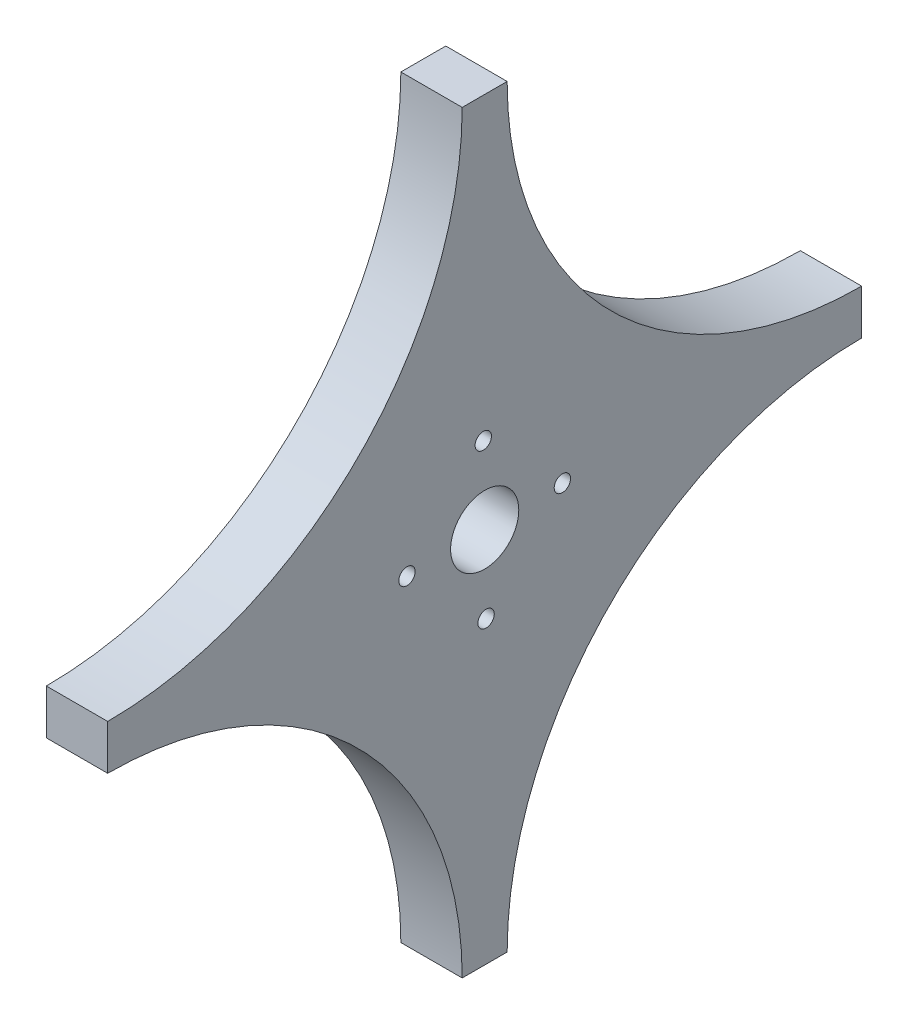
SolidWorks part; units mm, degrees
ref_plane "Front Plane" through (0, 0, 0) normal (0, 0, 1) x (1, 0, 0)
ref_plane "Top Plane" through (0, 0, 0) normal (0, 1, 0) x (1, 0, 0)
ref_plane "Right Plane" through (0, 0, 0) normal (1, 0, 0) x (0, 0, -1)
sketch "Sketch1" plane through (0, 0, 0) normal (1, 0, 0) x (0, 0, -1)
  line L0 (2.0928, 35.1128) -> (-2.0928, 35.1128)
  line L1 (2.0928, 35.1128) -> (2.0928, 64.3697) construction
  line L2 (35.1128, 2.0928) -> (86.5266, 2.0928) construction
  line L3 (35.1128, 2.0928) -> (35.1128, -2.0928)
  line L5 (-2.0928, -35.1128) -> (2.0928, -35.1128)
  line L6 (-35.1128, 2.0928) -> (-35.1128, -2.0928)
  line L7 (35.1128, -2.0928) -> (35.1128, 2.0928)
  circle A1 centre (0, 0) radius 3.175
  arc A6 (2.0928, 35.1128) -> (35.1128, 2.0928) centre (35.1128, 35.1128) ccw
  arc A7 (35.1128, -2.0928) -> (2.0928, -35.1128) centre (35.1128, -35.1128) ccw
  arc A8 (-2.0928, -35.1128) -> (-35.1128, -2.0928) centre (-35.1128, -35.1128) ccw
  arc A9 (-35.1128, 2.0928) -> (-2.0928, 35.1128) centre (-35.1128, 35.1128) ccw
  point P9 (36.1282, 0)
  point P10 (11.7641, 11.7641)
  point P11 (0, 35.1128)
  point P27 (0, 0)
  dimension "D1" = 6.35
  dimension "D2" = 33.02
  dimension "D4" = 16.637
  dimension "D3" = 4
extrude "Boss-Extrude1" add sketch "Sketch1" along normal blind 5.715
sketch "Sketch3" plane through (5.715, 0, 0) normal (-1, 0, 0) x (0, 0, 1)
  circle A0 centre (7.1766, -3.4965) radius 0.762 construction
  circle A1 centre (7.2378, -0.1316) radius 0.762 construction
  circle A2 centre (7.299, 3.2334) radius 0.762 construction
  circle A3 centre (3.4965, 7.1766) radius 0.762 construction
  circle A4 centre (0.1316, 7.2378) radius 0.762 construction
  circle A5 centre (-3.2334, 7.299) radius 0.762 construction
  circle A6 centre (-7.1766, 3.4965) radius 0.762 construction
  circle A7 centre (-7.2378, 0.1316) radius 0.762 construction
  circle A8 centre (-7.299, -3.2334) radius 0.762 construction
  circle A9 centre (-3.4965, -7.1766) radius 0.762 construction
  circle A10 centre (-0.1316, -7.2378) radius 0.762 construction
  circle A11 centre (3.2334, -7.299) radius 0.762 construction
  circle A12 centre (7.1766, -3.4965) radius 0.762 construction
  circle A13 centre (7.2378, -0.1316) radius 0.762
  circle A14 centre (7.299, 3.2334) radius 0.762 construction
  circle A15 centre (3.4965, 7.1766) radius 0.762 construction
  circle A16 centre (0.1316, 7.2378) radius 0.762
  circle A17 centre (-3.2334, 7.299) radius 0.762 construction
  circle A18 centre (-7.1766, 3.4965) radius 0.762 construction
  circle A19 centre (-7.2378, 0.1316) radius 0.762
  circle A20 centre (-7.299, -3.2334) radius 0.762 construction
  circle A21 centre (-3.4965, -7.1766) radius 0.762 construction
  circle A22 centre (-0.1316, -7.2378) radius 0.762
  circle A23 centre (3.2334, -7.299) radius 0.762 construction
extrude "Cut-Extrude3" cut sketch "Sketch3" along normal through all
